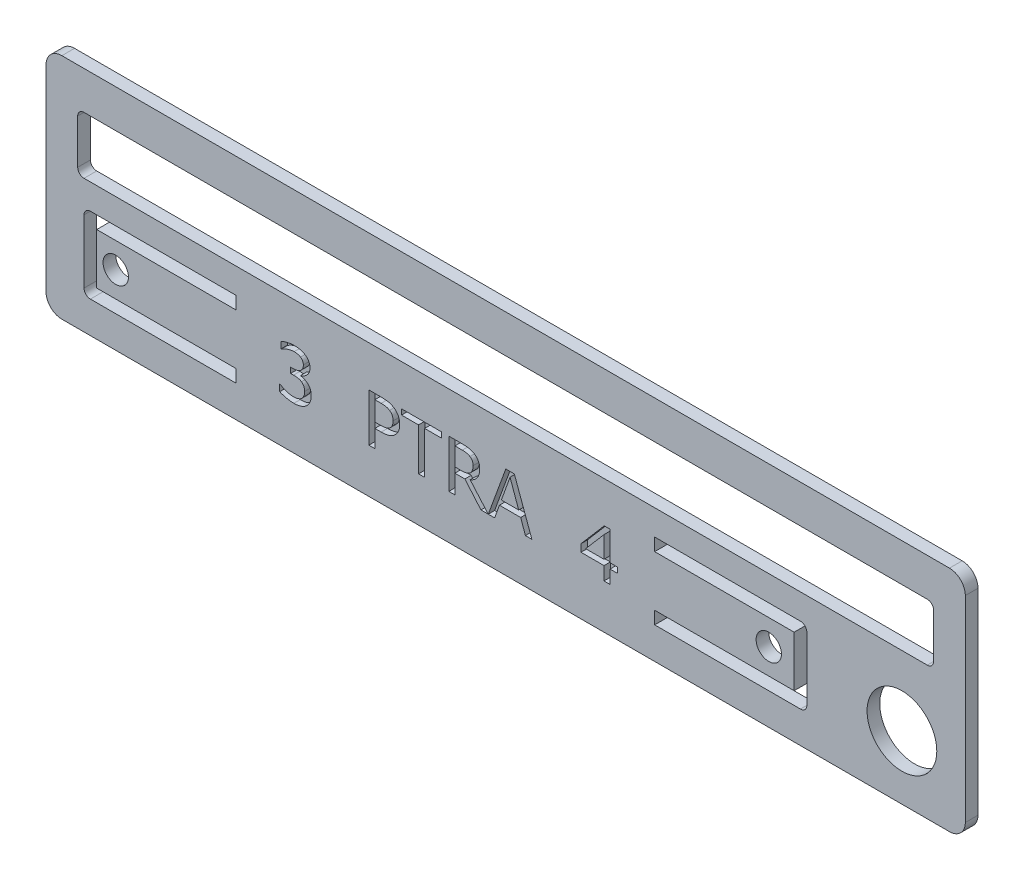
SolidWorks part; units mm, degrees
ref_plane "Plan de face" through (0, 0, 0) normal (0, 0, 1) x (1, 0, 0)
ref_plane "Plan de dessus" through (0, 0, 0) normal (0, 1, 0) x (1, 0, 0)
ref_plane "Plan de droite" through (0, 0, 0) normal (1, 0, 0) x (0, 0, -1)
sketch "Esquisse1" plane through (0, 0, 0) normal (0, 0, 1) x (1, 0, 0)
  line L0 (96, 15) -> (118, 15)
  line L1 (2.5, 36) -> (142.5, 36)
  line L2 (0, 33.5) -> (0, 2.5)
  line L3 (2.5, 0) -> (142.5, 0)
  line L4 (145, 33.5) -> (145, 2.5)
  line L5 (6, 30) -> (139, 30)
  line L6 (5, 29) -> (5, 22)
  line L7 (6, 21) -> (139, 21)
  line L8 (140, 29) -> (140, 22)
  line L9 (7, 17) -> (30, 17)
  line L10 (6, 16) -> (6, 6)
  line L11 (7, 5) -> (30, 5)
  line L12 (120, 16) -> (120, 6)
  line L13 (8, 15) -> (30, 15)
  line L14 (8, 15) -> (8, 7)
  line L15 (8, 7) -> (30, 7)
  line L16 (118, 15) -> (118, 7)
  line L17 (96, 7) -> (96, 5)
  line L18 (30, 17) -> (30, 15)
  line L19 (30, 7) -> (30, 5)
  line L20 (96, 17) -> (96, 15)
  line L21 (96, 17) -> (119, 17)
  line L22 (96, 7) -> (118, 7)
  line L23 (96, 5) -> (119, 5)
  arc A0 (2.5, 36) -> (0, 33.5) centre (2.5, 33.5) ccw
  arc A1 (0, 2.5) -> (2.5, 0) centre (2.5, 2.5) ccw
  arc A2 (142.5, 0) -> (145, 2.5) centre (142.5, 2.5) ccw
  arc A3 (142.5, 36) -> (145, 33.5) centre (142.5, 33.5) cw
  circle A4 centre (135, 10) radius 5.5
  arc A5 (6, 30) -> (5, 29) centre (6, 29) ccw
  arc A6 (5, 22) -> (6, 21) centre (6, 22) ccw
  arc A7 (139, 21) -> (140, 22) centre (139, 22) ccw
  arc A8 (139, 30) -> (140, 29) centre (139, 29) cw
  circle A9 centre (11, 11) radius 2
  circle A10 centre (114, 11) radius 2
  arc A11 (119, 17) -> (120, 16) centre (119, 16) cw
  arc A12 (119, 5) -> (120, 6) centre (119, 6) ccw
  arc A13 (7, 17) -> (6, 16) centre (7, 16) ccw
  arc A14 (6, 6) -> (7, 5) centre (7, 6) ccw
  point P6 (0, 36)
  point P9 (0, 0)
  point P12 (145, 0)
  point P23 (5, 30)
  point P26 (5, 21)
  point P29 (140, 21)
  dimension "D3" = 4
  dimension "D8" = 2
  dimension "D1" = 1
  dimension "D2" = 3
  dimension "D4" = 22
  dimension "D5" = 30
  dimension "D6" = 66
  dimension "D7" = 2
extrude "Extrusion1" add sketch "Esquisse1" along normal blind 2
sketch "Esquisse3" plane through (0, 0, 2) normal (0, 0, 1) x (1, 0, 0)
  text T0 "3  PTRA  4" font "Verdana" height in points 28
  dimension "D1" = 36
  dimension "D2" = 7
extrude "Enlèv. mat.-Extru.1" cut sketch "Esquisse3" against normal blind 1
